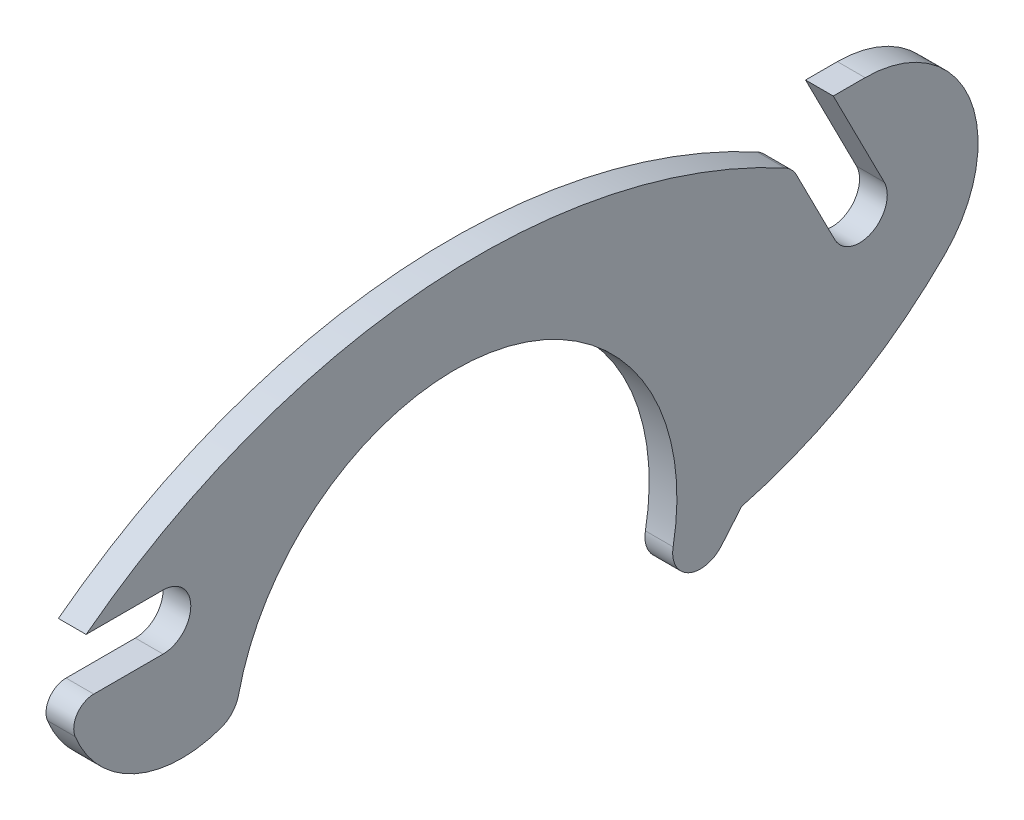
SolidWorks part; units mm, degrees
ref_plane "Plano frontal" through (0, 0, 0) normal (0, 0, 1) x (1, 0, 0)
ref_plane "Plano superior" through (0, 0, 0) normal (0, 1, 0) x (1, 0, 0)
ref_plane "Plano direito" through (0, 0, 0) normal (1, 0, 0) x (0, 0, -1)
sketch "Esboço1" plane through (0, 0, 0) normal (1, 0, 0) x (0, 0, -1)
  line L0 (-3.5492, 3.5596) -> (18.4489, 3.2542) construction
  line L1 (47.891, 19.3892) -> (51.5686, 12.1716)
  line L2 (45.2376, 15.7861) -> (48.0046, 10.3556)
  line L3 (47.891, 19.3892) -> (50.1882, 19.3892)
  line L4 (39.8371, -4.6561) -> (41.2777, -2.9459)
  line L5 (0, 0) -> (0, 28.2985) construction
  line L6 (-6, 12.7) -> (-0.4496, 12.7)
  line L7 (-5.4464, 8.7) -> (-0.4496, 8.7)
  arc A0 (3.7308, 2.001) -> (-6.7884, 6.7107) centre (0.9189, 9.823) cw
  arc A1 (-6, 12.7) -> (44.4096, 16.6346) centre (22.2496, -24.3421) cw
  arc A2 (3.7308, 2.001) -> (5.0017, 3.4409) centre (3.0563, 3.8772) ccw
  arc A3 (48.0046, 10.3556) -> (51.5686, 12.1716) centre (49.7866, 11.2636) ccw
  arc A4 (5.0017, 3.4409) -> (36.3416, -3) centre (20.614, -0.0601) cw
  arc A5 (36.3416, -3) -> (39.8371, -4.6561) centre (38.3075, -3.3675) ccw
  arc A6 (41.2777, -2.9459) -> (55.9565, 5.4851) centre (33.0924, 28.2985) ccw
  arc A7 (50.1882, 19.3892) -> (55.9565, 5.4851) centre (50.1882, 11.2406) cw
  arc A8 (44.4096, 16.6346) -> (45.2376, 15.7861) centre (43.4612, 14.8809) cw
  arc A10 (-0.4496, 8.7) -> (-0.4496, 12.7) centre (-0.4496, 10.7) ccw
  arc A13 (-6.7884, 6.7107) -> (-5.4464, 8.7) centre (-5.4464, 7.2526) cw
  point P8 (45.6812, 19.3892)
  point P26 (44.9591, 16.3327)
  point P29 (-7.466, 8.8922)
  dimension "D6" = 8.312
  dimension "D7" = 3
  dimension "D10" = 16
  dimension "D11" = 2
  dimension "D2" = 8.7
  dimension "D3" = 4
  dimension "D4" = 9
  dimension "D5" = 6
  dimension "D12" = 5
  dimension "D13" = 27
  dimension "D15" = 4
extrude "Ressalto-extrusão1" add sketch "Esboço1" along normal blind 2
